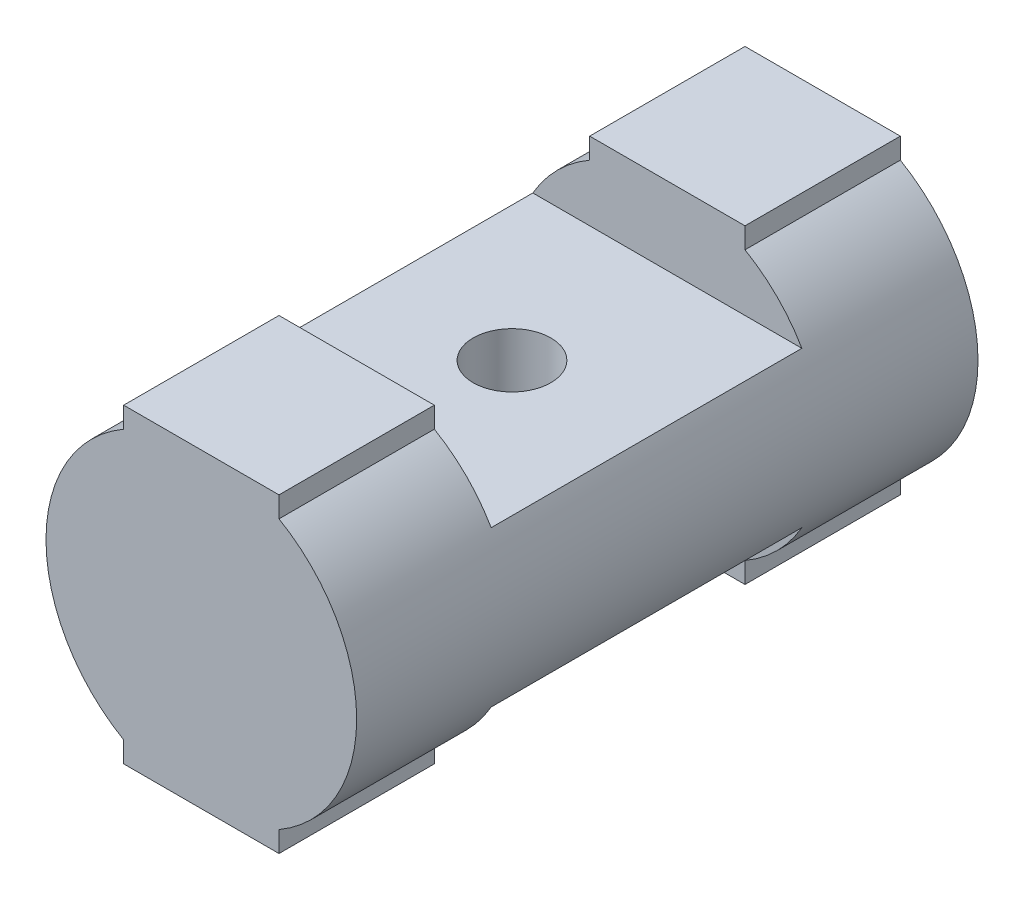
SolidWorks part; units mm, degrees
ref_plane "Front Plane" through (0, 0, 0) normal (0, 0, 1) x (1, 0, 0)
ref_plane "Top Plane" through (0, 0, 0) normal (0, 1, 0) x (1, 0, 0)
ref_plane "Right Plane" through (0, 0, 0) normal (1, 0, 0) x (0, 0, -1)
sketch "Sketch1" plane through (0, 0, 0) normal (0, 0, 1) x (1, 0, 0)
  circle A0 centre (0, 0) radius 10
  dimension "D1" = 20
extrude "Boss-Extrude1" add sketch "Sketch1" along normal mid plane 40
sketch "Sketch2" plane through (0, 0, 20) normal (0, 0, 1) x (1, 0, 0)
  line L1 (5, -10) -> (-5, -10)
  line L2 (5, -10) -> (5, 10)
  line L3 (5, 10) -> (-5, 10)
  line L4 (-5, -10) -> (-5, 10)
  line L5 (5, -10) -> (-5, 10) construction
  line L6 (5, 10) -> (-5, -10) construction
  circle A0 centre (0, 0) radius 10 construction
  point P0 (0, 0)
  dimension "D2" = 10
extrude "Boss-Extrude2" add sketch "Sketch2" against normal up to surface (40 mm away)
sketch "Sketch3" plane through (0, 0, 0) normal (0, 0, 1) x (1, 0, 0)
  line L1 (8.6603, 5) -> (-8.6603, 5)
  line L2 (8.6603, 5) -> (8.6603, 10)
  line L3 (8.6603, 10) -> (-8.6603, 10)
  line L4 (-8.6603, 5) -> (-8.6603, 10)
  line L5 (8.6603, 5) -> (-8.6603, 10) construction
  line L6 (8.6603, 10) -> (-8.6603, 5) construction
  circle A0 centre (0, 0) radius 10 construction
  point P0 (0, 7.5)
  dimension "D1" = 5
extrude "Cut-Extrude1" cut sketch "Sketch3" against normal mid plane 20
mirror "Mirror1" about plane through (0, 0, 0) normal (0, 1, 0) of "Cut-Extrude1"
sketch "Sketch4" plane through (0, 5, 0) normal (0, 1, 0) x (1, 0, 0)
  circle A0 centre (0, 0) radius 2.5
  dimension "D1" = 5
extrude "Cut-Extrude2" cut sketch "Sketch4" against normal through all
